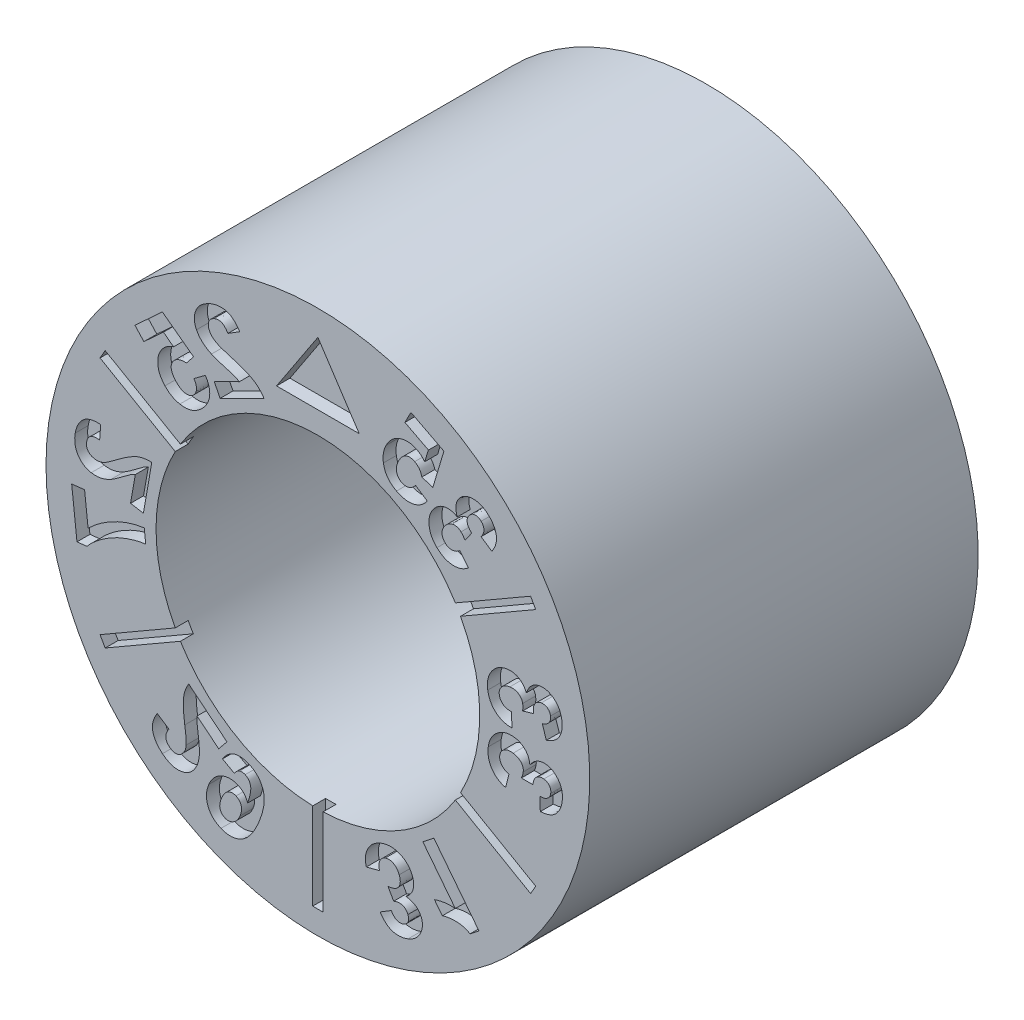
SolidWorks part; units mm, degrees
ref_plane "Front Plane" through (0, 0, 0) normal (0, 0, 1) x (1, 0, 0)
ref_plane "Top Plane" through (0, 0, 0) normal (0, 1, 0) x (1, 0, 0)
ref_plane "Right Plane" through (0, 0, 0) normal (1, 0, 0) x (0, 0, -1)
imported_body "Imported1"
other "DeleteFace1"
other "Move Face1" parameters "D1"=0.11
sketch "Sketch1" plane through (0, 0, 0) normal (0, 0, 1) x (1, 0, 0)
  line L0 (0, 0) -> (0, 2.2775) construction
  line L1 (0, 0) -> (1.1387, 1.9723) construction
  line L2 (0, 0) -> (1.9723, 1.1387) construction
  line L3 (0, 0) -> (2.2775, 0) construction
  line L4 (0, 0) -> (1.9723, -1.1387) construction
  line L5 (0, 0) -> (1.1387, -1.9723) construction
  line L6 (0, 0) -> (0, -2.2775) construction
  line L7 (0, 0) -> (-1.1387, -1.9723) construction
  line L8 (0, 0) -> (-1.9723, -1.1387) construction
  line L9 (0, 0) -> (-2.2775, 0) construction
  line L10 (0, 0) -> (-1.9723, 1.1387) construction
  line L11 (0, 0) -> (-1.1387, 1.9723) construction
  line L12 (-1.0592, -0.5654) -> (-1.0192, -0.6346)
  line L13 (-0.04, -1.2) -> (0.04, -1.2)
  line L14 (-0.04, -1.2) -> (-0.04, -1.92)
  line L15 (-0.04, -1.92) -> (0.04, -1.92)
  line L16 (0.04, -1.2) -> (0.04, -1.92)
  line L17 (-1.0192, -0.6346) -> (-1.6428, -0.9946)
  line L18 (-1.0592, -0.5654) -> (-1.6828, -0.9254)
  line L19 (-1.6828, -0.9254) -> (-1.6428, -0.9946)
  line L20 (-1.0192, 0.6346) -> (-1.0592, 0.5654)
  line L21 (-1.0592, 0.5654) -> (-1.6828, 0.9254)
  line L22 (-1.0192, 0.6346) -> (-1.6428, 0.9946)
  line L23 (-1.6428, 0.9946) -> (-1.6828, 0.9254)
  line L28 (1.0592, 0.5654) -> (1.0192, 0.6346)
  line L29 (1.0192, 0.6346) -> (1.6428, 0.9946)
  line L30 (1.0592, 0.5654) -> (1.6828, 0.9254)
  line L31 (1.6828, 0.9254) -> (1.6428, 0.9946)
  line L32 (1.0192, -0.6346) -> (1.0592, -0.5654)
  line L33 (1.0592, -0.5654) -> (1.6828, -0.9254)
  line L34 (1.0192, -0.6346) -> (1.6428, -0.9946)
  line L35 (1.6428, -0.9946) -> (1.6828, -0.9254)
  line L36 (0.04, 1.92) -> (-0.04, 1.92)
  line L37 (0.04, 1.2) -> (0.04, 1.92)
  line L38 (-0.04, 1.2) -> (-0.04, 1.92)
  line L39 (0.04, 1.2) -> (-0.04, 1.2)
  arc A0 (-0.3969, 1.2956) -> (0, 1.355) centre (0, 0) ccw construction
  text T0 "25   27    29    31    33   35" font "Arial" height 0.57
  point P18 (0, 0)
  point P44 (0, 0)
  dimension "D1" = 2.71
  dimension "D2" = 12
  dimension "D7" = 6
extrude "Cut-Extrude1" cut sketch "Sketch1" against normal blind 0.1
